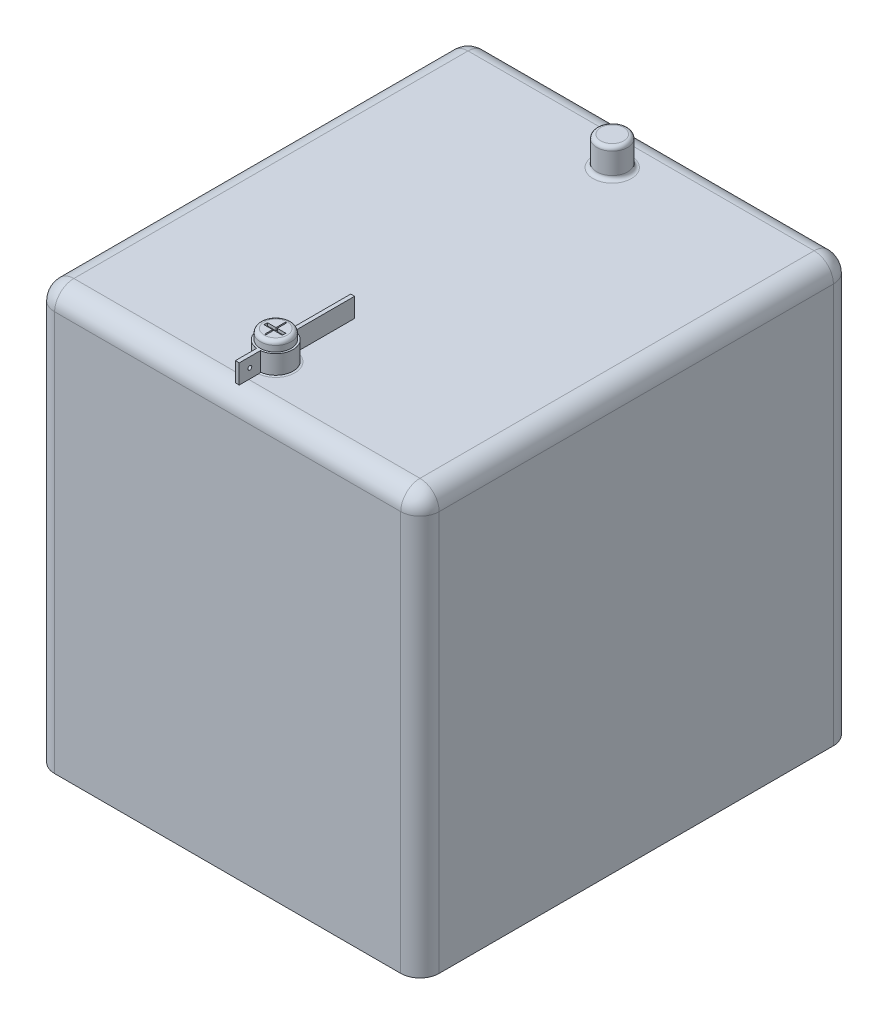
SolidWorks part; units mm, degrees
ref_plane "Front" through (0, 0, 0) normal (0, 0, 1) x (1, 0, 0)
ref_plane "Top" through (0, 0, 0) normal (0, 1, 0) x (1, 0, 0)
ref_plane "Right" through (0, 0, 0) normal (1, 0, 0) x (0, 0, -1)
sketch "Sketch1" plane through (0, 0, 0) normal (0, 0, 1) x (1, 0, 0)
  line L1 (-65, 109) -> (65, 109)
  line L2 (-65, 109) -> (-65, -109)
  line L3 (-65, -109) -> (65, -109)
  line L4 (65, 109) -> (65, -109)
  dimension "D1" = 130
  dimension "D2" = 218
  dimension "D3" = 109
  dimension "D4" = 65
extrude "Extrude1" add sketch "Sketch1" along normal mid plane 225
fillet "Fillet1" radius 10 8 edges at (65, 0, 112.5) (-65, 0, 112.5) (65, 0, -112.5) (-65, 0, -112.5) (65, 109, 0) (0, 109, -112.5) (0, 109, 112.5) (-65, 109, 0)
sketch "Sketch4" plane through (0, 109, 0) normal (0, 1, 0) x (-1, 0, 0)
  line L0 (65, 102.5) -> (65, -102.5) construction
  line L1 (0, 0) -> (130.7536, 0) construction
  circle A0 centre (35, 87.5) radius 8
  circle A1 centre (35, -87.5) radius 8
  dimension "D2" = 16
  dimension "D3" = 30
  dimension "D1" = 87.5
extrude "Extrude4" add sketch "Sketch4" along normal blind 15
fillet "Fillet6" radius 2 4 edges at (-27, 124, -87.5) (-43, 124, 87.5) (-27, 109, 87.5) (-27, 109, -87.5)
sketch "Sketch5" plane through (0, 124, 0) normal (0, 1, 0) x (-1, 0, 0)
  line L0 (35.3282, 87.0449) -> (35.3282, 82.1431)
  line L1 (33.4589, 92.9437) -> (35.3282, 92.9437)
  line L2 (33.4589, 92.9437) -> (33.4589, 88.8727)
  line L3 (33.4589, 82.1431) -> (35.3282, 82.1431)
  line L4 (35.3282, 92.9437) -> (35.3282, 88.8727)
  line L5 (28.8064, 88.8727) -> (33.4589, 88.8727)
  line L6 (28.8064, 88.8727) -> (28.8064, 87.0449)
  line L7 (28.8064, 87.0449) -> (33.4589, 87.0449)
  line L8 (39.7731, 88.8727) -> (39.7731, 87.0449)
  line L9 (33.4589, 87.0449) -> (33.4589, 82.1431)
  line L10 (35.3282, 88.8727) -> (39.7731, 88.8727)
  line L11 (35.3282, 87.0449) -> (39.7731, 87.0449)
  line L13 (36.4589, -82.5905) -> (38.3282, -82.5905)
  line L14 (36.4589, -82.5905) -> (36.4589, -91.9787)
  line L15 (36.4589, -91.9787) -> (38.3282, -91.9787)
  line L16 (38.3282, -82.5905) -> (38.3282, -91.9787)
extrude "Cut-Extrude1" cut sketch "Sketch5" against normal blind 1.5
sketch "Sketch7" plane through (0, 109, 0) normal (0, 1, 0) x (1, 0, 0)
  line L0 (-35, -47.5) -> (-35, -79.5)
  line L1 (-34, -47.5) -> (-34, -78.5557)
  line L2 (-35, -107.5) -> (-34, -107.5)
  line L3 (-35, -47.5) -> (-34, -47.5)
  line L4 (-35, -95.5) -> (-35, -107.5)
  line L5 (-34, -96.4443) -> (-34, -107.5)
  circle A0 centre (-35, -87.5) radius 8 construction
  arc A1 (-35, -95.5) -> (-35, -79.5) centre (-35, -87.5) ccw
  arc A2 (-34, -96.4443) -> (-34, -78.5557) centre (-35, -87.5) ccw
  dimension "D2" = 1
  dimension "D1" = 1
  dimension "D3" = 40
  dimension "D4" = 20
extrude "Extrude5" add sketch "Sketch7" along normal blind 10
mirror "Mirror1" about plane through (-35, 119, 47.5) normal (1, 0, 0)
sketch "Sketch8" plane through (-36, 0, 0) normal (-1, 0, 0) x (0, 0, 1)
  line L0 (96.4443, 119) -> (107.5, 109) construction
  circle A0 centre (101.9721, 114) radius 1
  dimension "D1" = 2
extrude "Cut-Extrude2" cut sketch "Sketch8" against normal through all
